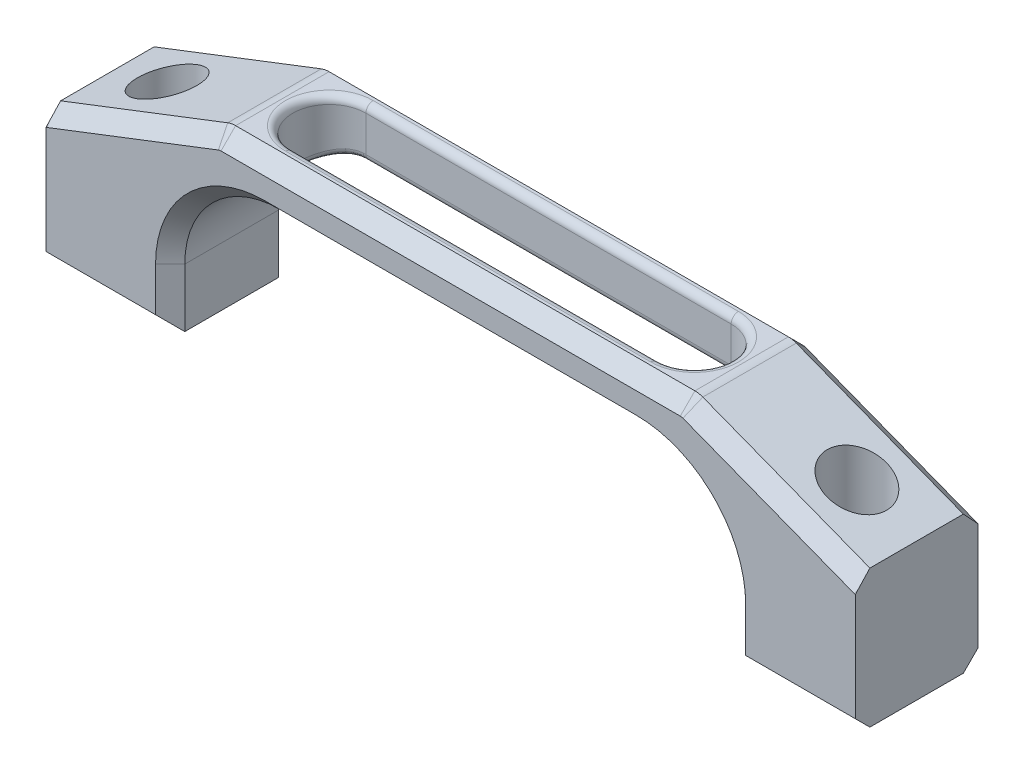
SolidWorks part; units mm, degrees
ref_plane "Front Plane" through (0, 0, 0) normal (0, 0, 1) x (1, 0, 0)
ref_plane "Top Plane" through (0, 0, 0) normal (0, 1, 0) x (1, 0, 0)
ref_plane "Right Plane" through (0, 0, 0) normal (1, 0, 0) x (0, 0, -1)
sketch "Sketch1" plane through (0, 0, 0) normal (0, 0, 1) x (1, 0, 0)
  line L0 (-73.533, -35.4315) -> (-48.768, -35.4315)
  line L1 (-48.768, -35.4315) -> (-48.768, -25.2715)
  line L2 (-32.258, -8.7615) -> (32.258, -8.7615)
  line L3 (-73.533, -35.4315) -> (-73.533, -15.3117)
  line L4 (-71.0952, -11.7573) -> (-41.3023, -0.2557)
  line L5 (-39.9301, 0) -> (39.9301, 0)
  line L6 (0, 39.3343) -> (0, -36.5468) construction
  line L7 (71.0952, -11.7573) -> (41.3023, -0.2557)
  line L8 (73.533, -35.4315) -> (73.533, -15.3117)
  line L9 (48.768, -35.4315) -> (48.768, -25.2715)
  line L10 (73.533, -35.4315) -> (48.768, -35.4315)
  arc A0 (-32.258, -8.7615) -> (-48.768, -25.2715) centre (-32.258, -25.2715) ccw
  arc A1 (-71.0952, -11.7573) -> (-73.533, -15.3117) centre (-69.723, -15.3117) ccw
  arc A2 (-39.9301, 0) -> (-41.3023, -0.2557) centre (-39.9301, -3.81) ccw
  arc A3 (39.9301, 0) -> (41.3023, -0.2557) centre (39.9301, -3.81) cw
  arc A4 (71.0952, -11.7573) -> (73.533, -15.3117) centre (69.723, -15.3117) cw
  arc A5 (32.258, -8.7615) -> (48.768, -25.2715) centre (32.258, -25.2715) cw
  point P12 (-48.768, -8.7615)
  point P15 (-73.533, -12.6985)
  point P18 (-40.64, 0)
  point P28 (0, 0)
  point P29 (0, -8.7615)
  dimension "D7" = 16.51
  dimension "D8" = 3.81
  dimension "D9" = 3.81
  dimension "D1" = 24.765
  dimension "D2" = 40.64
  dimension "D3" = 22.733
  dimension "D4" = 26.67
  dimension "D5" = 48.768
  dimension "D6" = 35.4315
extrude "Extrude1" add sketch "Sketch1" along normal mid plane 21.336
chamfer "Chamfer1" distance 2.54 angle 45 16 edges at (-72.865, -13.1567, 10.668) (-56.1987, -6.0065, 10.668) (-40.628, -0.0645, 10.668) (0, 0, 10.668) (40.628, -0.0645, 10.668) (56.1987, -6.0065, 10.668) (72.865, -13.1567, 10.668) (73.533, -25.3716, 10.668) (61.1505, -35.4315, 10.668) (48.768, -30.3515, 10.668) (43.9323, -13.5971, 10.668) (0, -8.7615, 10.668) (-43.9323, -13.5971, 10.668) (-48.768, -30.3515, 10.668) (-61.1505, -35.4315, 10.668) (-73.533, -25.3716, 10.668)
chamfer "Chamfer2" distance 2.54 angle 45 16 edges at (-61.1505, -35.4315, -10.668) (-48.768, -30.3515, -10.668) (-43.9323, -13.5971, -10.668) (0, -8.7615, -10.668) (43.9323, -13.5971, -10.668) (48.768, -30.3515, -10.668) (61.1505, -35.4315, -10.668) (73.533, -25.3716, -10.668) (72.865, -13.1567, -10.668) (56.1987, -6.0065, -10.668) (40.628, -0.0645, -10.668) (0, 0, -10.668) (-40.628, -0.0645, -10.668) (-56.1987, -6.0065, -10.668) (-72.865, -13.1567, -10.668) (-73.533, -25.3716, -10.668)
ref_plane "Plane1" through (0, -4.9515, 0) normal (0, -1, 0) x (1, 0, 0)
hole_wizard "CBORE for 1/4 Socket Shoulder Screw1" positions "Sketch6" profile "Sketch5" counterbore size "1/4" standard "Ansi Inch"
sketch "Sketch6" plane through (0, -4.9515, 0) normal (0, -1, 0) x (1, 0, 0)
  line L0 (0, 0) -> (-83.5639, 0) construction
  line L1 (0, 30.8604) -> (0, -28.3561) construction
  point P0 (-59.9694, 0)
  point P6 (59.9694, 0)
  dimension "D1" = 119.9388
sketch "Sketch5" plane through (-59.9694, -4.9515, 0) normal (1, 0, 0) x (0, 0, 1)
  line L0 (0, 0) -> (0, 30.48)
  line L1 (0, 30.48) -> (3.3782, 30.48)
  line L3 (3.3782, 30.48) -> (3.3782, 12.7)
  line L4 (3.3782, 12.7) -> (5.1587, 12.7)
  line L5 (5.1587, 12.7) -> (5.1587, 0)
  line L7 (5.1587, 0) -> (0, 0)
  line L11 (0, -6.35) -> (0, 107.95) construction
  dimension "Thru Hole Dia." = 6.7564
  dimension "Thru Hole Depth" = 30.48
  dimension "C'Bore Dia." = 10.3175
  dimension "C'Bore Depth" = 12.7
sketch "Sketch7" plane through (0, 0, 0) normal (0, 1, 0) x (-1, 0, 0)
  line L0 (-75.0285, 0) -> (76.4297, 0) construction
  line L1 (-31.75, -6.35) -> (31.75, -6.35)
  line L3 (-31.75, 6.35) -> (31.75, 6.35)
  line L5 (0, -33.4219) -> (0, 34.074) construction
  arc A0 (-31.75, -6.35) -> (-31.75, 6.35) centre (-31.75, 0) cw
  arc A1 (31.75, -6.35) -> (31.75, 6.35) centre (31.75, 0) ccw
  dimension "D1" = 12.7
  dimension "D2" = 63.5
extrude "Cut-Extrude1" cut sketch "Sketch7" against normal through all
fillet "Fillet2" radius 1.27 12 edges at (32.0042, -8.7615, -6.3449) (38.0806, -9.8223, -0.496) (32.0042, -8.7615, 6.3449) (-32.0042, -8.7615, 6.3449) (-38.0806, -9.8223, 0.496) (-32.0042, -8.7615, -6.3449) (38.1, 0, 0) (-38.1, 0, 0) (0, -8.7615, 6.35) (0, 0, 6.35) (0, -8.7615, -6.35) (0, 0, -6.35)
sketch "Sketch8" plane through (-73.533, 0, 0) normal (-1, 0, 0) x (0, 0, 1)
  line L1 (12.4823, -10.4344) -> (-12.4303, -10.4344)
  line L2 (12.4823, -10.4344) -> (12.4823, -40.5999)
  line L3 (12.4823, -40.5999) -> (-12.4303, -40.5999)
  line L4 (-12.4303, -10.4344) -> (-12.4303, -40.5999)
extrude "Cut-Extrude2" cut sketch "Sketch8" against normal blind 3.175
mirror "Mirror1" about plane through (0, 0, 0) normal (1, 0, 0) of "Cut-Extrude2"
sketch "Sketch9" [suppressed] plane through (0, -35.4315, 0) normal (0, -1, 0) x (1, 0, 0)
  line L1 (-71.7172, 11.8407) -> (-47.4056, 11.8407)
  line L2 (-71.7172, 11.8407) -> (-71.7172, -11.742)
  line L3 (-71.7172, -11.742) -> (-47.4056, -11.742)
  line L4 (-47.4056, 11.8407) -> (-47.4056, -11.742)
extrude "Cut-Extrude3" [suppressed] cut sketch "Sketch9" against normal blind 2.413
